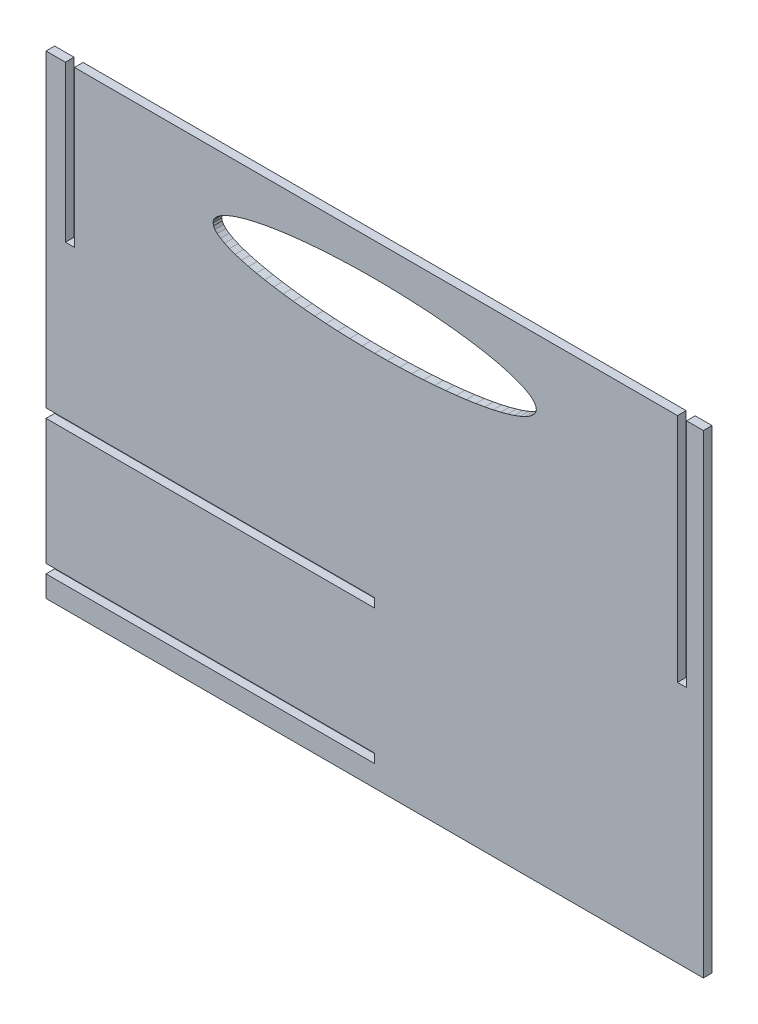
SolidWorks part; units mm, degrees
ref_plane "Спереди" through (0, 0, 0) normal (0, 0, 1) x (1, 0, 0)
ref_plane "Сверху" through (0, 0, 0) normal (0, 1, 0) x (1, 0, 0)
ref_plane "Справа" through (0, 0, 0) normal (1, 0, 0) x (0, 0, -1)
sketch "Model" plane through (0, 0, 0) normal (0, 0, 1) x (1, 0, 0)
  line L0 (-1791.7164, -1043.0194) -> (-1786.1217, -1042.8014)
  line L1 (-1786.1217, -1042.8014) -> (-1780.6829, -1042.5019)
  line L2 (-1780.6829, -1042.5019) -> (-1775.4167, -1042.1243)
  line L3 (-1775.4167, -1042.1243) -> (-1770.34, -1041.672)
  line L4 (-1770.34, -1041.672) -> (-1765.4694, -1041.1483)
  line L5 (-1765.4694, -1041.1483) -> (-1760.8218, -1040.5566)
  line L6 (-1760.8218, -1040.5566) -> (-1756.4138, -1039.9002)
  line L7 (-1756.4138, -1039.9002) -> (-1752.2622, -1039.1825)
  line L8 (-1752.2622, -1039.1825) -> (-1748.3837, -1038.4068)
  line L9 (-1748.3837, -1038.4068) -> (-1744.7952, -1037.5765)
  line L10 (-1744.7952, -1037.5765) -> (-1741.5133, -1036.6949)
  line L11 (-1741.5133, -1036.6949) -> (-1738.5548, -1035.7654)
  line L12 (-1738.5548, -1035.7654) -> (-1735.9365, -1034.7913)
  line L13 (-1735.9365, -1034.7913) -> (-1733.675, -1033.7759)
  line L14 (-1733.675, -1033.7759) -> (-1731.7871, -1032.7227)
  line L15 (-1731.7871, -1032.7227) -> (-1730.2896, -1031.6349)
  line L16 (-1730.2896, -1031.6349) -> (-1729.1992, -1030.516)
  line L17 (-1729.1992, -1030.516) -> (-1728.5327, -1029.3692)
  line L18 (-1728.5327, -1029.3692) -> (-1728.3068, -1028.1979)
  line L19 (-1728.3068, -1028.1979) -> (-1728.5327, -1027.0267)
  line L20 (-1728.5327, -1027.0267) -> (-1729.1992, -1025.8799)
  line L21 (-1729.1992, -1025.8799) -> (-1730.2896, -1024.7609)
  line L22 (-1730.2896, -1024.7609) -> (-1731.7871, -1023.6732)
  line L23 (-1731.7871, -1023.6732) -> (-1733.675, -1022.6199)
  line L24 (-1733.675, -1022.6199) -> (-1735.9365, -1021.6046)
  line L25 (-1735.9365, -1021.6046) -> (-1738.5548, -1020.6305)
  line L26 (-1738.5548, -1020.6305) -> (-1741.5133, -1019.7009)
  line L27 (-1741.5133, -1019.7009) -> (-1744.7952, -1018.8193)
  line L28 (-1744.7952, -1018.8193) -> (-1748.3837, -1017.989)
  line L29 (-1748.3837, -1017.989) -> (-1752.2622, -1017.2133)
  line L30 (-1752.2622, -1017.2133) -> (-1756.4138, -1016.4956)
  line L31 (-1756.4138, -1016.4956) -> (-1760.8218, -1015.8392)
  line L32 (-1760.8218, -1015.8392) -> (-1765.4694, -1015.2475)
  line L33 (-1765.4694, -1015.2475) -> (-1770.34, -1014.7238)
  line L34 (-1770.34, -1014.7238) -> (-1775.4167, -1014.2715)
  line L35 (-1775.4167, -1014.2715) -> (-1780.6829, -1013.894)
  line L36 (-1780.6829, -1013.894) -> (-1786.1217, -1013.5945)
  line L37 (-1786.1217, -1013.5945) -> (-1791.7164, -1013.3764)
  line L38 (-1791.7164, -1013.3764) -> (-1797.4504, -1013.2431)
  line L39 (-1797.4504, -1013.2431) -> (-1803.3067, -1013.1979)
  line L40 (-1803.3067, -1013.1979) -> (-1809.1631, -1013.2431)
  line L41 (-1809.1631, -1013.2431) -> (-1814.897, -1013.3764)
  line L42 (-1814.897, -1013.3764) -> (-1820.4918, -1013.5945)
  line L43 (-1820.4918, -1013.5945) -> (-1825.9306, -1013.894)
  line L44 (-1825.9306, -1013.894) -> (-1831.1967, -1014.2715)
  line L45 (-1831.1967, -1014.2715) -> (-1836.2735, -1014.7238)
  line L46 (-1836.2735, -1014.7238) -> (-1841.1441, -1015.2475)
  line L47 (-1841.1441, -1015.2475) -> (-1845.7917, -1015.8392)
  line L48 (-1845.7917, -1015.8392) -> (-1850.1997, -1016.4956)
  line L49 (-1850.1997, -1016.4956) -> (-1854.3513, -1017.2133)
  line L50 (-1854.3513, -1017.2133) -> (-1858.2298, -1017.989)
  line L51 (-1858.2298, -1017.989) -> (-1861.8183, -1018.8193)
  line L52 (-1861.8183, -1018.8193) -> (-1865.1002, -1019.7009)
  line L53 (-1865.1002, -1019.7009) -> (-1868.0587, -1020.6305)
  line L54 (-1868.0587, -1020.6305) -> (-1870.6771, -1021.6046)
  line L55 (-1870.6771, -1021.6046) -> (-1872.9386, -1022.6199)
  line L56 (-1872.9386, -1022.6199) -> (-1874.8265, -1023.6731)
  line L57 (-1874.8265, -1023.6731) -> (-1876.324, -1024.7609)
  line L58 (-1876.324, -1024.7609) -> (-1877.4143, -1025.8798)
  line L59 (-1877.4143, -1025.8798) -> (-1878.0808, -1027.0266)
  line L60 (-1878.0808, -1027.0266) -> (-1878.3067, -1028.1979)
  line L61 (-1878.3067, -1028.1979) -> (-1878.0808, -1029.3692)
  line L62 (-1878.0808, -1029.3692) -> (-1877.4143, -1030.516)
  line L63 (-1877.4143, -1030.516) -> (-1876.324, -1031.6349)
  line L64 (-1876.324, -1031.6349) -> (-1874.8265, -1032.7227)
  line L65 (-1874.8265, -1032.7227) -> (-1872.9386, -1033.7759)
  line L66 (-1872.9386, -1033.7759) -> (-1870.6771, -1034.7913)
  line L67 (-1870.6771, -1034.7913) -> (-1868.0587, -1035.7654)
  line L68 (-1868.0587, -1035.7654) -> (-1865.1002, -1036.6949)
  line L69 (-1865.1002, -1036.6949) -> (-1861.8183, -1037.5765)
  line L70 (-1861.8183, -1037.5765) -> (-1858.2298, -1038.4068)
  line L71 (-1858.2298, -1038.4068) -> (-1854.3513, -1039.1825)
  line L72 (-1854.3513, -1039.1825) -> (-1850.1997, -1039.9002)
  line L73 (-1850.1997, -1039.9002) -> (-1845.7917, -1040.5566)
  line L74 (-1845.7917, -1040.5566) -> (-1841.1441, -1041.1483)
  line L75 (-1841.1441, -1041.1483) -> (-1836.2735, -1041.672)
  line L76 (-1836.2735, -1041.672) -> (-1831.1967, -1042.1243)
  line L77 (-1831.1967, -1042.1243) -> (-1825.9306, -1042.5019)
  line L78 (-1825.9306, -1042.5019) -> (-1820.4918, -1042.8014)
  line L79 (-1820.4918, -1042.8014) -> (-1814.897, -1043.0194)
  line L80 (-1814.897, -1043.0194) -> (-1809.1631, -1043.1527)
  line L81 (-1809.1631, -1043.1527) -> (-1803.3067, -1043.1979)
  line L82 (-1803.3067, -1043.1979) -> (-1797.4504, -1043.1527)
  line L83 (-1797.4504, -1043.1527) -> (-1791.7164, -1043.0194)
  line L84 (-1955.8066, -1141.3763) -> (-1955.8066, -997.9528)
  line L85 (-1955.8066, -997.9528) -> (-1946.8022, -997.9528)
  line L86 (-1946.8022, -997.9528) -> (-1946.8022, -1070.3008)
  line L87 (-1946.8022, -1070.3008) -> (-1946.7022, -1070.3008)
  line L88 (-1946.7022, -1070.3008) -> (-1942.7023, -1070.3008)
  line L89 (-1942.7023, -1070.3008) -> (-1942.6022, -1070.3008)
  line L90 (-1942.6022, -1070.3008) -> (-1942.6022, -997.9528)
  line L91 (-1942.6022, -997.9528) -> (-1662.8024, -997.9528)
  line L92 (-1662.8024, -997.9528) -> (-1662.8024, -1105.1696)
  line L93 (-1662.8024, -1105.1696) -> (-1662.7024, -1105.1696)
  line L94 (-1662.7024, -1105.1696) -> (-1658.7024, -1105.1696)
  line L95 (-1658.7024, -1105.1696) -> (-1658.6024, -1105.1696)
  line L96 (-1658.6024, -1105.1696) -> (-1658.6024, -997.9528)
  line L97 (-1658.6024, -997.9528) -> (-1650.8067, -997.9528)
  line L98 (-1650.8067, -997.9528) -> (-1650.8067, -1217.9527)
  line L99 (-1650.8067, -1217.9527) -> (-1955.8066, -1217.9527)
  line L100 (-1955.8066, -1217.9527) -> (-1955.8066, -1208.0527)
  line L101 (-1955.8066, -1208.0527) -> (-1803.325, -1208.0527)
  line L102 (-1803.325, -1208.0527) -> (-1803.325, -1207.9526)
  line L103 (-1803.325, -1207.9526) -> (-1803.325, -1203.9526)
  line L104 (-1803.325, -1203.9526) -> (-1803.325, -1203.8527)
  line L105 (-1803.325, -1203.8527) -> (-1955.8066, -1203.8527)
  line L106 (-1955.8066, -1203.8527) -> (-1955.8066, -1145.5763)
  line L107 (-1955.8066, -1145.5763) -> (-1803.325, -1145.5763)
  line L108 (-1803.325, -1145.5763) -> (-1803.325, -1145.4763)
  line L109 (-1803.325, -1145.4763) -> (-1803.325, -1141.4763)
  line L110 (-1803.325, -1141.4763) -> (-1803.325, -1141.3763)
  line L111 (-1803.325, -1141.3763) -> (-1955.8066, -1141.3763)
extrude "Бобышка-Вытянуть1" add sketch "Model" along normal blind 4
